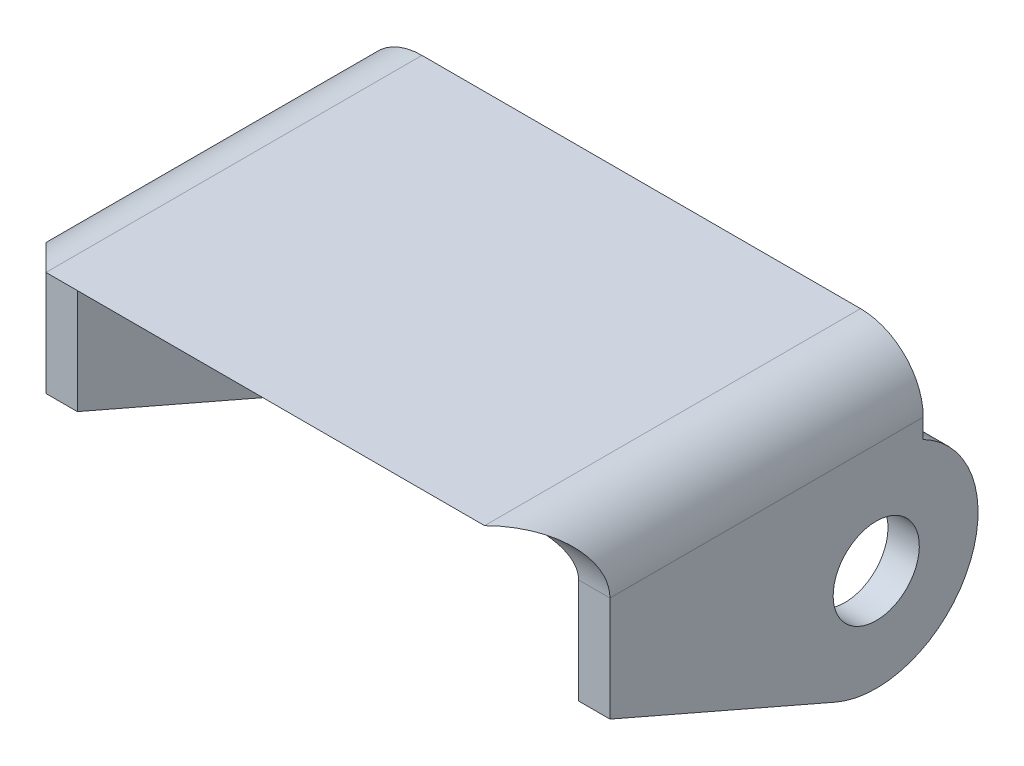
SolidWorks part; units mm, degrees
ref_plane "FRONT" through (0, 0, 0) normal (0, 0, 1) x (1, 0, 0)
ref_plane "TOP" through (0, 0, 0) normal (0, 1, 0) x (1, 0, 0)
ref_plane "RIGHT" through (0, 0, 0) normal (1, 0, 0) x (0, 0, -1)
sketch "Sketch1" plane through (0, 0, 0) normal (0, 0, 1) x (1, 0, 0)
  line L0 (-50.8, -57.15) -> (-57.15, -57.15)
  line L1 (-57.15, -57.15) -> (-57.15, -12.7)
  line L2 (-44.45, 0) -> (44.45, 0)
  line L3 (57.15, -12.7) -> (57.15, -57.15)
  line L4 (57.15, -57.15) -> (50.8, -57.15)
  line L5 (50.8, -57.15) -> (50.8, -12.7)
  line L6 (44.45, -6.35) -> (-44.45, -6.35)
  line L7 (-50.8, -12.7) -> (-50.8, -57.15)
  arc A0 (-44.45, 0) -> (-57.15, -12.7) centre (-44.45, -12.7) ccw
  arc A1 (57.15, -12.7) -> (44.45, 0) centre (44.45, -12.7) ccw
  arc A2 (50.8, -12.7) -> (44.45, -6.35) centre (44.45, -12.7) ccw
  arc A3 (-44.45, -6.35) -> (-50.8, -12.7) centre (-44.45, -12.7) ccw
  point P0 (0, 0)
  dimension "D4" = 6.35
  dimension "D1" = 57.15
  dimension "D2" = 114.3
  dimension "D3" = 6.35
extrude "Extrude1" add sketch "Sketch1" along normal blind 88.9
sketch "Sketch2" plane through (57.15, 0, 0) normal (1, 0, 0) x (0, 0, -1)
  line L0 (-88.9, 0) -> (0, 0) construction
  line L1 (0, -12.7) -> (0, 0) construction
  circle A0 centre (-22.225, -34.925) radius 8.7313
  dimension "D1" = 17.4625
  dimension "D2" = 34.925
  dimension "D3" = 22.225
extrude "Extrude2" cut sketch "Sketch2" against normal through all
sketch "Sketch3" plane through (57.15, 0, 0) normal (1, 0, 0) x (0, 0, -1)
  line L0 (-30.4542, -53.8508) -> (-76.2, -33.96)
  line L1 (-76.2, -33.96) -> (-76.2, -12.7)
  line L2 (-88.9, 0) -> (-88.9, -12.7) construction
  line L3 (-88.9, -57.15) -> (-88.9, -12.7) construction
  line L4 (-12.7, 0) -> (-12.7, -16.6171)
  line L5 (-88.9, 0) -> (0, 0) construction
  line L7 (-88.9, -57.15) -> (0, -57.15) construction
  arc A0 (-30.4542, -53.8508) -> (-12.7, -16.6171) centre (-22.225, -34.925) ccw
  arc A1 (-76.2, -12.7) -> (-88.9, 0) centre (-88.9, -12.7) ccw
  circle A2 centre (-22.225, -34.925) radius 8.7313 construction
  dimension "D1" = 20.6375
  dimension "D2" = 12.7
  dimension "D3" = 76.2
  dimension "D4" = 23.5
extrude "Extrude3" cut sketch "Sketch3" against normal through all
ref_plane "Plane1" through (0, 0, 0) normal (-1, 0, 0) x (0, 0, 1)
